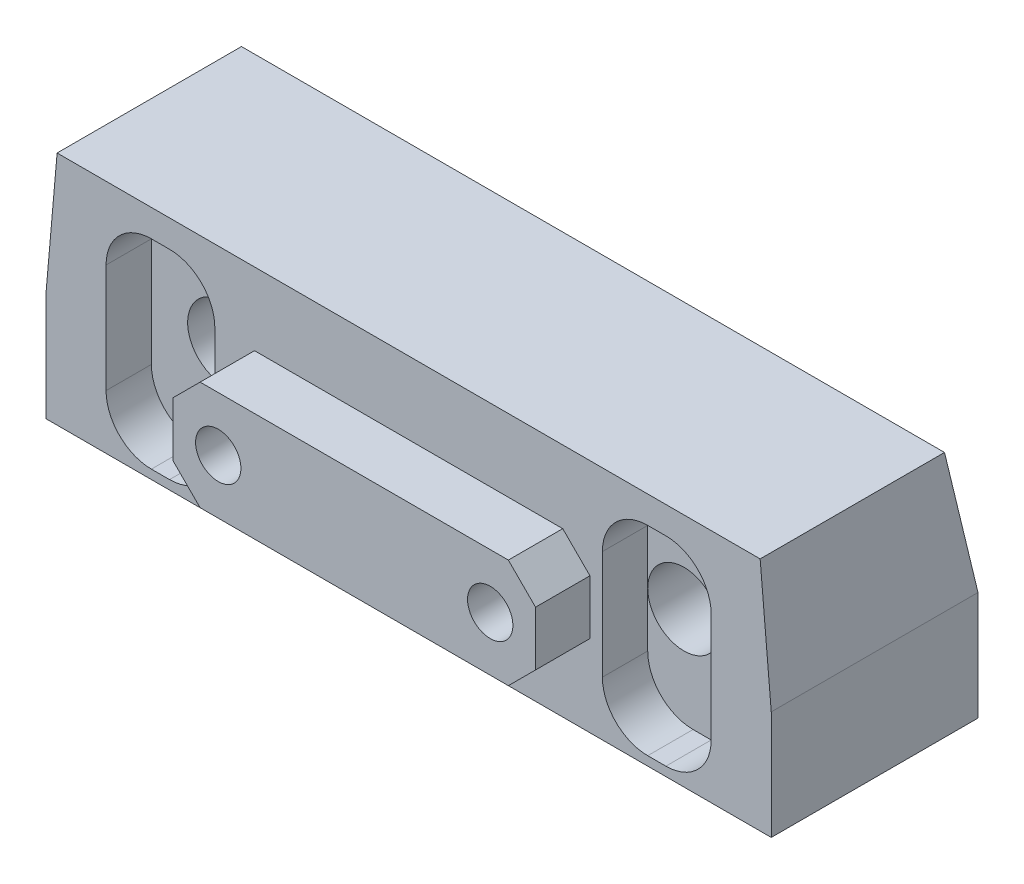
SolidWorks part; units mm, degrees
ref_plane "Plan de face" through (0, 0, 0) normal (0, 0, 1) x (1, 0, 0)
ref_plane "Plan de dessus" through (0, 0, 0) normal (0, 1, 0) x (1, 0, 0)
ref_plane "Plan de droite" through (0, 0, 0) normal (1, 0, 0) x (0, 0, -1)
imported_body "Importée1"
fillet "Congé3" radius 0.5
